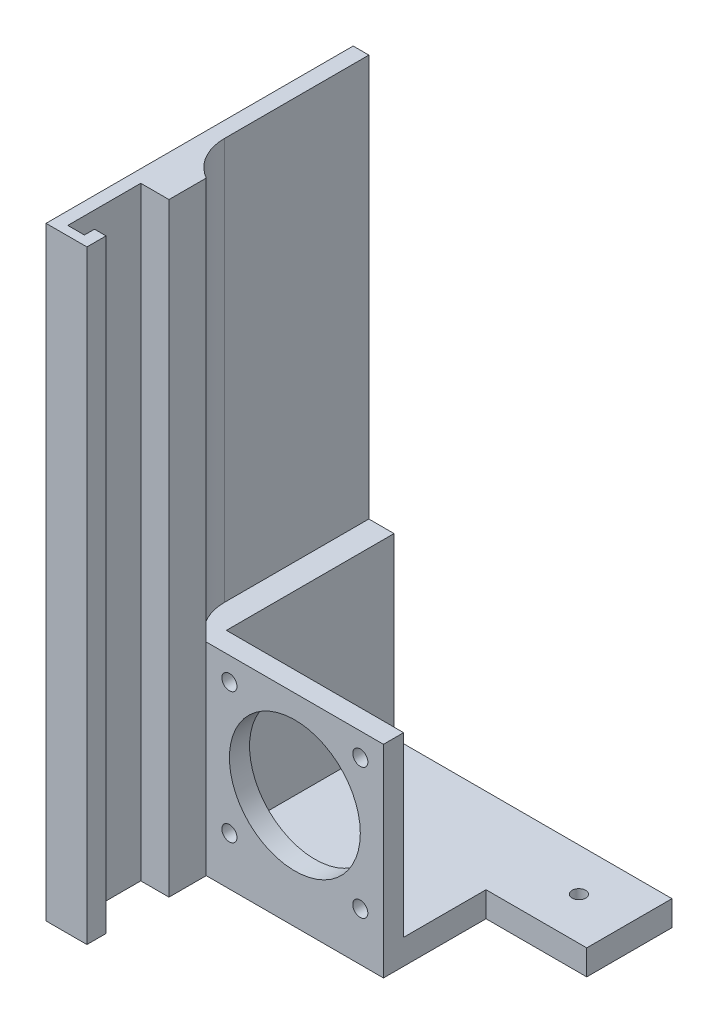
SolidWorks part; units mm, degrees
ref_plane "Front Plane" through (0, 0, 0) normal (0, 0, 1) x (1, 0, 0)
ref_plane "Top Plane" through (0, 0, 0) normal (0, 1, 0) x (1, 0, 0)
ref_plane "Right Plane" through (0, 0, 0) normal (1, 0, 0) x (0, 0, -1)
sketch "Sketch1" plane through (0, 0, 0) normal (0, 0, 1) x (1, 0, 0)
  line L1 (-17.6, 17.6) -> (17.6, 17.6)
  line L2 (-17.6, 17.6) -> (-17.6, -17.6)
  line L3 (-17.6, -17.6) -> (17.6, -17.6)
  line L4 (17.6, 17.6) -> (17.6, -17.6)
  line L5 (-17.6, 17.6) -> (17.6, -17.6) construction
  line L6 (-17.6, -17.6) -> (17.6, 17.6) construction
  circle A0 centre (-12.9966, -12.9966) radius 1.5
  circle A1 centre (12.9966, -12.9966) radius 1.5
  circle A2 centre (-12.9966, 12.9966) radius 1.5
  circle A3 centre (12.9966, 12.9966) radius 1.5
  circle A4 centre (0, 0) radius 13
  point P0 (0, 0)
  point P5 (-12.9966, 12.9966)
  point P6 (-12.9966, -12.9966)
  point P8 (12.9966, -12.9966)
  point P9 (12.9966, 12.9966)
  dimension "D7" = 3
  dimension "D8" = 3
  dimension "D9" = 3
  dimension "D10" = 3
  dimension "D11" = 26
  dimension "D1" = 35.2
  dimension "D2" = 35.2
  dimension "D3" = 18.38
  dimension "D4" = 18.38
  dimension "D5" = 18.38
  dimension "D6" = 18.38
extrude "Boss-Extrude1" add sketch "Sketch1" along normal blind 4
sketch "Sketch2" plane through (0, -17.6, 0) normal (0, -1, 0) x (1, 0, 0)
  line L1 (-17.6, 4) -> (17.6, 4)
  line L2 (-17.6, 4) -> (-17.6, -33.3)
  line L3 (-17.6, -33.3) -> (17.6, -33.3)
  line L4 (17.6, 4) -> (17.6, -33.3)
  dimension "D1" = 35.2
  dimension "D2" = 37.3
extrude "Boss-Extrude2" add sketch "Sketch2" along normal blind 5 contours L2 L3 L4 L1
sketch "Sketch4" plane through (-17.6, 0, 0) normal (-1, 0, 0) x (0, 0, 1)
  line L5 (4, -22.6) -> (-33.3, -22.6)
  line L6 (4, -22.6) -> (4, 17.6)
  line L7 (4, 17.6) -> (-33.3, 17.6)
  line L8 (-33.3, -22.6) -> (-33.3, 17.6)
  dimension "D1" = 40.2
  dimension "D2" = 37.3
extrude "Boss-Extrude3" add sketch "Sketch4" along normal blind 5
sketch "Sketch5" plane through (-22.6, 0, 0) normal (-1, 0, 0) x (0, 0, 1)
  line L1 (-33.3, -22.6) -> (4, -22.6)
  line L2 (-33.3, -22.6) -> (-33.3, 157.4)
  line L3 (-33.3, 157.4) -> (4, 157.4)
  line L4 (4, -22.6) -> (4, 157.4)
  dimension "D1" = 37.3
  dimension "D2" = 180
extrude "Boss-Extrude4" add sketch "Sketch5" along normal blind 3.12
sketch "Sketch6" plane through (0, 0, 4) normal (0, 0, 1) x (1, 0, 0)
  line L1 (-22.6, 157.4) -> (-25.72, 157.4)
  line L2 (-22.6, 157.4) -> (-22.6, -22.6)
  line L3 (-22.6, -22.6) -> (-25.72, -22.6)
  line L4 (-25.72, 157.4) -> (-25.72, -22.6)
extrude "Boss-Extrude5" add sketch "Sketch6" along normal blind 23.7
sketch "Sketch7" plane through (-22.6, 0, 0) normal (1, 0, 0) x (0, 0, -1)
  line L0 (-27.7, 157.4) -> (33.3, 157.4) construction
  line L1 (-27.7, -22.6) -> (-25.9, -22.6)
  line L2 (-27.7, -22.6) -> (-27.7, 157.4)
  line L3 (-27.7, 157.4) -> (-25.9, 157.4)
  line L4 (-25.9, -22.6) -> (-25.9, 157.4)
  dimension "D1" = 1.8
extrude "Boss-Extrude6" add sketch "Sketch7" along normal blind 3
sketch "Sketch11" plane through (-19.6, 0, 0) normal (1, 0, 0) x (0, 0, -1)
  line L1 (-27.7, 157.4) -> (-23.9, 157.4)
  line L2 (-27.7, 157.4) -> (-27.7, -22.6)
  line L3 (-27.7, -22.6) -> (-23.9, -22.6)
  line L4 (-23.9, 157.4) -> (-23.9, -22.6)
  dimension "D1" = 180
  dimension "D2" = 3.8
extrude "Boss-Extrude7" add sketch "Sketch11" along normal blind 2
sketch "Sketch13" plane through (-22.6, 0, 0) normal (1, 0, 0) x (0, 0, -1)
  line L0 (-25.9, 157.4) -> (33.3, 157.4) construction
  line L1 (-4, -22.6) -> (-11.4, -22.6)
  line L2 (-4, -22.6) -> (-4, 157.4)
  line L3 (-4, 157.4) -> (-11.4, 157.4)
  line L4 (-11.4, -22.6) -> (-11.4, 157.4)
  dimension "D1" = 7.4
extrude "Boss-Extrude8" add sketch "Sketch13" along normal blind 5
fillet "Fillet2" radius 10 1 edges at (-22.6, 87.5, 4)
sketch "Sketch14" plane through (0, 157.4, 0) normal (0, 1, 0) x (1, 0, 0)
  line L1 (-22.6, -25.9) -> (-23.2, -25.9)
  line L2 (-22.6, -25.9) -> (-22.6, -11.4)
  line L3 (-22.6, -11.4) -> (-23.2, -11.4)
  line L4 (-23.2, -25.9) -> (-23.2, -11.4)
  dimension "D1" = 14.5
  dimension "D2" = 0.6
extrude "Cut-Extrude2" cut sketch "Sketch14" against normal blind 200
sketch "Sketch15" plane through (0, 157.4, 0) normal (0, 1, 0) x (1, 0, 0)
  line L0 (-19.6, -25.9) -> (-23.2, -25.9) construction
  line L1 (-19.6, -23.9) -> (-19.9, -23.9)
  line L2 (-19.6, -23.9) -> (-19.6, -25.9)
  line L3 (-19.6, -25.9) -> (-19.9, -25.9)
  line L4 (-19.9, -23.9) -> (-19.9, -25.9)
  dimension "D1" = 0.3
extrude "Boss-Extrude9" add sketch "Sketch15" against normal blind 180
ref_plane "Plane1" through (-17.6, 157.4, 27.7) normal (0, -1, 0) x (-1, 0, 0)
sketch "Sketch17" plane through (-17.6, 0, 0) normal (1, 0, 0) x (0, 0, -1)
  line L0 (33.3, 157.4) -> (33.3, 17.6) construction
  line L1 (-27.7, 157.4) -> (33.3, 157.4)
  line L2 (-27.7, 157.4) -> (-27.7, 97.4)
  line L3 (-27.7, 97.4) -> (33.3, 97.4)
  line L4 (33.3, 157.4) -> (33.3, 97.4)
  dimension "D1" = 60
extrude "Cut-Extrude3" cut sketch "Sketch17" against normal blind 20
sketch "Sketch18" plane through (17.6, 0, 0) normal (1, 0, 0) x (0, 0, -1)
  line L0 (-4, -22.6) -> (33.3, -22.6) construction
  line L1 (33.3, -17.6) -> (16.37, -17.6)
  line L2 (33.3, -17.6) -> (33.3, -22.6)
  line L3 (33.3, -22.6) -> (16.37, -22.6)
  line L4 (16.37, -17.6) -> (16.37, -22.6)
  line L5 (16.37, -22.6) -> (16.37, -37.6) construction
extrude "Boss-Extrude10" add sketch "Sketch18" along normal blind 20
sketch "Sketch19" plane through (0, -17.6, 0) normal (0, 1, 0) x (1, 0, 0)
  line L0 (37.6, 33.3) -> (37.6, 16.37) construction
  line L1 (-17.6, 33.3) -> (37.6, 33.3) construction
  circle A0 centre (27.6, 24.83) radius 1.35
  dimension "D1" = 2.7
  dimension "D2" = 10
  dimension "D3" = 8.47
extrude "Cut-Extrude4" cut sketch "Sketch19" against normal blind 10
sketch "Sketch22" plane through (-25.72, 0, 0) normal (-1, 0, 0) x (0, 0, 1)
  line L0 (-33.3, 97.4) -> (-33.3, -22.6) construction
  line L1 (-33.3, -17.6) -> (-16.37, -17.6)
  line L2 (-33.3, -17.6) -> (-33.3, -22.6)
  line L3 (-33.3, -22.6) -> (-16.37, -22.6)
  line L4 (-16.37, -17.6) -> (-16.37, -22.6)
  line L5 (-33.3, -22.6) -> (27.7, -22.6) construction
  dimension "D1" = 16.93
  dimension "D2" = 5
extrude "Boss-Extrude11" add sketch "Sketch22" along normal blind 20.08
sketch "Sketch23" plane through (0, -17.6, 0) normal (0, 1, 0) x (1, 0, 0)
  line L0 (-45.8, 16.37) -> (-25.72, 16.37) construction
  line L1 (-45.8, 16.37) -> (-45.8, 33.3) construction
  circle A0 centre (-35.8, 24.84) radius 1.35
  dimension "D1" = 2.7
  dimension "D2" = 8.47
  dimension "D3" = 10
extrude "Cut-Extrude5" cut sketch "Sketch23" against normal blind 10
